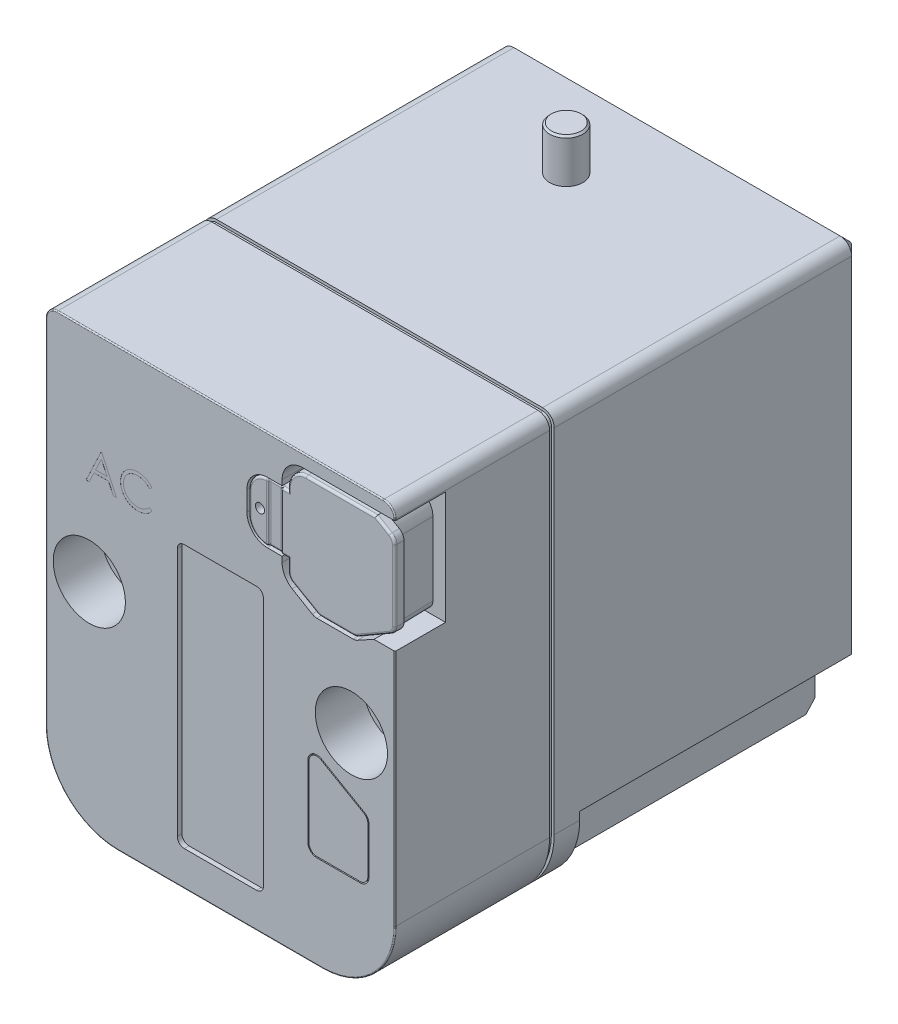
SolidWorks part; units mm, degrees
other "Move Face1"
ref_plane "Front Plane" through (0, 0, 0) normal (0, 0, 1) x (1, 0, 0)
ref_plane "Top Plane" through (0, 0, 0) normal (0, 1, 0) x (1, 0, 0)
ref_plane "Right Plane" through (0, 0, 0) normal (1, 0, 0) x (0, 0, -1)
imported_body "Imported1"
imported_body "Imported2"
imported_body "Imported3"
sketch "Sketch1" plane through (0, 0, 0) normal (0, 0, 1) x (1, 0, 0)
  text T0 "AC"
extrude "Cut-Extrude1" cut sketch "Sketch1" against normal blind 0.005
